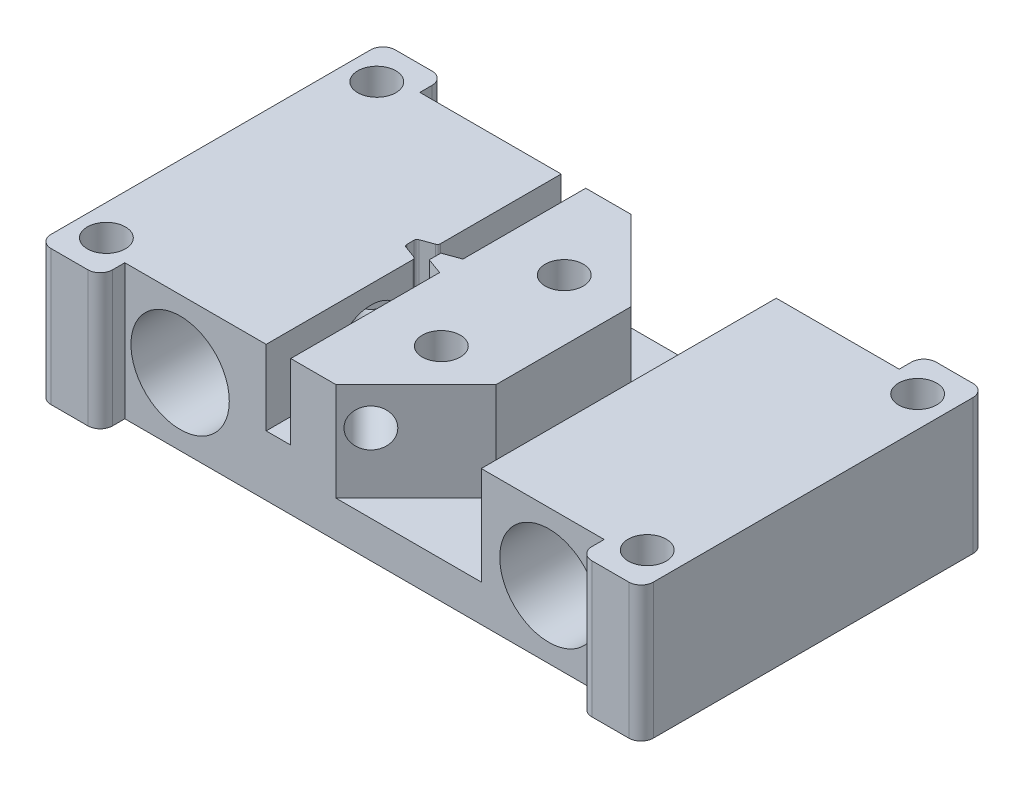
SolidWorks part; units mm, degrees
ref_plane "Piano frontale" through (0, 0, 0) normal (0, 0, 1) x (1, 0, 0)
ref_plane "Piano superiore" through (0, 0, 0) normal (0, 1, 0) x (1, 0, 0)
ref_plane "Piano destro" through (0, 0, 0) normal (1, 0, 0) x (0, 0, -1)
sketch "Schizzo8" plane through (0, 0, 0) normal (0, 1, 0) x (1, 0, 0)
  line L0 (-8, -1) -> (-6.9455, -1.3838)
  line L1 (-6.9455, -2.2061) -> (-7.32, -2.3424)
  line L2 (-6.86, -1.7949) -> (-8, -1.7949) construction
  line L3 (-8, -1) -> (-8, -2.5899)
  line L4 (-6.86, -1.506) -> (-6.86, -2.0839)
  line L5 (-7.32, -2.3424) -> (-7.32, -3.2795)
  line L6 (-8, -2.5899) -> (-8, -19.783)
  line L7 (-7.32, -4.3744) -> (-7.32, -5.3115)
  line L8 (-7.32, -6.4064) -> (-7.32, -7.3435)
  line L9 (-8, -3.032) -> (-8, -4.6219)
  line L10 (-6.9455, -4.2381) -> (-7.32, -4.3744)
  line L11 (-6.86, -3.538) -> (-6.86, -4.1159)
  line L12 (-7.32, -3.2795) -> (-6.9455, -3.4158)
  line L13 (-8, -5.064) -> (-8, -6.6539)
  line L14 (-6.9455, -6.2701) -> (-7.32, -6.4064)
  line L15 (-6.86, -5.57) -> (-6.86, -6.1479)
  line L16 (-7.32, -5.3115) -> (-6.9455, -5.4478)
  line L17 (-8, -7.096) -> (-8, -8.6859)
  line L18 (-6.9455, -8.3021) -> (-7.32, -8.4384)
  line L19 (-6.86, -7.602) -> (-6.86, -8.1799)
  line L20 (-7.32, -7.3435) -> (-6.9455, -7.4798)
  line L21 (-8, -9.128) -> (-8, -10.7179)
  line L22 (-6.9455, -10.3341) -> (-7.32, -10.4704)
  line L23 (-6.86, -9.634) -> (-6.86, -10.2119)
  line L24 (-7.32, -9.3755) -> (-6.9455, -9.5118)
  line L25 (-8, -11.16) -> (-8, -12.7499)
  line L26 (-6.9455, -12.3661) -> (-7.32, -12.5024)
  line L27 (-6.86, -11.666) -> (-6.86, -12.2439)
  line L28 (-7.32, -11.4075) -> (-6.9455, -11.5438)
  line L29 (-8, -13.192) -> (-8, -14.7819)
  line L30 (-6.9455, -14.3981) -> (-7.32, -14.5344)
  line L31 (-6.86, -13.698) -> (-6.86, -14.2759)
  line L32 (-7.32, -13.4395) -> (-6.9455, -13.5758)
  line L33 (-8, -15.224) -> (-8, -16.8139)
  line L34 (-6.9455, -16.4301) -> (-7.32, -16.5664)
  line L35 (-6.86, -15.73) -> (-6.86, -16.3079)
  line L36 (-7.32, -15.4715) -> (-6.9455, -15.6078)
  line L37 (-8, -17.256) -> (-8, -18.8459)
  line L38 (-6.9455, -18.4621) -> (-7.32, -18.5984)
  line L39 (-6.86, -17.762) -> (-6.86, -18.3399)
  line L40 (-7.32, -17.5035) -> (-6.9455, -17.6398)
  line L41 (-8, -19.288) -> (-8, -19.783)
  line L45 (-7.32, -10.4704) -> (-7.32, -11.4075)
  line L46 (-7.32, -12.5024) -> (-7.32, -13.4395)
  line L47 (-7.32, -8.4384) -> (-7.32, -9.3755)
  line L48 (-7.32, -14.5344) -> (-7.32, -15.4715)
  line L49 (-7.32, -16.5664) -> (-7.32, -17.5035)
  line L50 (-7.32, -18.5984) -> (-7.32, -19.5355)
  line L52 (-7.32, -19.5355) -> (-8, -19.783)
  line L54 (-6.86, -19.794) -> (-6.86, -20.3719)
  line L55 (8.3119, -25.225) -> (8.6864, -25.3613)
  line L56 (22.6248, -9.7313) -> (21.5704, -10.1151)
  arc A0 (-6.86, -2.0839) -> (-6.9455, -2.2061) centre (-6.99, -2.0839) cw
  arc A1 (-6.86, -1.506) -> (-6.9455, -1.3838) centre (-6.99, -1.506) ccw
  arc A2 (-6.86, -4.1159) -> (-6.9455, -4.2381) centre (-6.99, -4.1159) cw
  arc A3 (-6.86, -3.538) -> (-6.9455, -3.4158) centre (-6.99, -3.538) ccw
  arc A4 (-6.86, -6.1479) -> (-6.9455, -6.2701) centre (-6.99, -6.1479) cw
  arc A5 (-6.86, -5.57) -> (-6.9455, -5.4478) centre (-6.99, -5.57) ccw
  arc A6 (-6.86, -8.1799) -> (-6.9455, -8.3021) centre (-6.99, -8.1799) cw
  arc A7 (-6.86, -7.602) -> (-6.9455, -7.4798) centre (-6.99, -7.602) ccw
  arc A8 (-6.86, -10.2119) -> (-6.9455, -10.3341) centre (-6.99, -10.2119) cw
  arc A9 (-6.86, -9.634) -> (-6.9455, -9.5118) centre (-6.99, -9.634) ccw
  arc A10 (-6.86, -12.2439) -> (-6.9455, -12.3661) centre (-6.99, -12.2439) cw
  arc A11 (-6.86, -11.666) -> (-6.9455, -11.5438) centre (-6.99, -11.666) ccw
  arc A12 (-6.86, -14.2759) -> (-6.9455, -14.3981) centre (-6.99, -14.2759) cw
  arc A13 (-6.86, -13.698) -> (-6.9455, -13.5758) centre (-6.99, -13.698) ccw
  arc A14 (-6.86, -16.3079) -> (-6.9455, -16.4301) centre (-6.99, -16.3079) cw
  arc A15 (-6.86, -15.73) -> (-6.9455, -15.6078) centre (-6.99, -15.73) ccw
  arc A16 (-6.86, -18.3399) -> (-6.9455, -18.4621) centre (-6.99, -18.3399) cw
  arc A17 (-6.86, -17.762) -> (-6.9455, -17.6398) centre (-6.99, -17.762) ccw
  arc A20 (-6.86, -19.794) -> (-6.9455, -19.6718) centre (-6.99, -19.794) ccw
  arc A21 (-6.86, -20.3719) -> (-6.9455, -20.4941) centre (-6.99, -20.3719) cw
  point P15 (-6.86, -2.1749)
  point P18 (-6.86, -1.4149)
  dimension "D5" = 0.13
  dimension "D1" = 20
  dimension "D2" = 0.76
  dimension "D3" = 0.9371
  dimension "D6" = 10
sketch "Schizzo1" plane through (0, 0, 0) normal (0, 0, 1) x (1, 0, 0)
  line L0 (-15, 0) -> (15, 0) construction
  line L2 (-24.5, -5.5) -> (24.5, -5.5)
  line L3 (-24.5, -5.5) -> (-24.5, 5.5)
  line L4 (-24.5, 5.5) -> (24.5, 5.5)
  line L5 (24.5, -5.5) -> (24.5, 5.5)
  line L6 (-24.5, -5.5) -> (24.5, 5.5) construction
  line L7 (-24.5, 5.5) -> (24.5, -5.5) construction
  circle A0 centre (-15, 0) radius 4
  circle A1 centre (15, 0) radius 4
  point P4 (0, 0)
  point P10 (0, 0)
  dimension "D2" = 8
  dimension "D1" = 30
  dimension "D3" = 11
  dimension "D4" = 49
extrude "Estrusione-Estrusione1" add sketch "Schizzo1" along normal blind 24
sketch "Schizzo3" plane through (0, 5.5, 0) normal (0, 1, 0) x (1, 0, 0)
  line L0 (24.5, 0) -> (-24.5, 0) construction
  line L1 (-8, 0) -> (-6, 0)
  line L2 (-8, 0) -> (-8, -9.8149)
  line L3 (-8, -24) -> (-6, -24)
  line L4 (-6, 0) -> (-6, -9.9899)
  line L5 (24.5, -24) -> (-24.5, -24) construction
  line L6 (0, 0) -> (0, -24) construction
  line L7 (8, -24) -> (6, -24) construction
  line L8 (8, 0) -> (8, -24) construction
  line L9 (6, 0) -> (6, -24) construction
  line L10 (8, 0) -> (6, 0) construction
  line L11 (-7.32, -10.4704) -> (-6, -9.9899)
  line L12 (-7.32, -11.4075) -> (-6, -11.8879)
  line L13 (-8.1645, -10.0498) -> (-9.1555, -10.4105)
  line L14 (-9.32, -10.6454) -> (-9.32, -11.2324)
  line L15 (-9.1555, -11.4674) -> (-8.1645, -11.8281)
  line L16 (-6, -11.8879) -> (-6, -24)
  line L17 (-8, -12.063) -> (-8, -24)
  line L18 (-7.32, -10.4704) -> (-7.32, -11.4075) construction
  line L19 (-6.9455, -10.3341) -> (-7.32, -10.4704) construction
  line L20 (-7.32, -11.4075) -> (-6.9455, -11.5438) construction
  line L21 (-7.32, -10.9389) -> (-9.32, -10.9389) construction
  line L22 (-8, -9.9899) -> (-6, -9.9899) construction
  line L23 (-7.32, -10.4704) -> (-7.32, -11.4075)
  arc A0 (-8.1645, -11.8281) -> (-8, -12.063) centre (-8.25, -12.063) cw
  arc A1 (-8.1645, -10.0498) -> (-8, -9.8149) centre (-8.25, -9.8149) ccw
  arc A2 (-9.32, -11.2324) -> (-9.1555, -11.4674) centre (-9.07, -11.2324) ccw
  arc A3 (-9.1555, -10.4105) -> (-9.32, -10.6454) centre (-9.07, -10.6454) ccw
  point P35 (-8, -11.8879)
  point P41 (-9.32, -11.4075)
  point P44 (-9.32, -10.4704)
  dimension "D3" = 0.25
  dimension "D1" = 2
  dimension "D2" = 6
extrude "Taglio-Estrusione2" cut sketch "Schizzo3" against normal blind 6.1
sketch "Schizzo4" plane through (0, 5.5, 0) normal (0, 1, 0) x (1, 0, 0)
  line L0 (24.5, 0) -> (-6, 0) construction
  line L1 (4.5, 0) -> (9.5, 0)
  line L2 (4.1898, -6.5) -> (4.1898, -17.5)
  line L3 (4.5, -24) -> (9.5, -24)
  line L4 (9.5, 0) -> (9.5, -24)
  line L6 (24.5, -24) -> (-6, -24) construction
  line L7 (4.1898, -17.5) -> (-2.3102, -24)
  line L8 (-2.3102, -24) -> (4.5, -24)
  line L9 (4.1898, -6.5) -> (-2.3102, 0)
  line L10 (24.5, 0) -> (-6, 0) construction
  line L11 (-2.3102, 0) -> (4.5, 0)
  line L12 (-2.3102, 0) -> (-2.3102, -24) construction
  dimension "D1" = 5
  dimension "D2" = 4.5
  dimension "D3" = 45
  dimension "D4" = 45
  dimension "D5" = 11
extrude "Taglio-Estrusione3" cut sketch "Schizzo4" against normal blind 8
sketch "Schizzo5" plane through (0, 5.5, 0) normal (0, 1, 0) x (1, 0, 0)
  line L1 (-24.5, 0) -> (-19.5, 0)
  line L2 (-24.5, 0) -> (-24.5, 2)
  line L3 (-24.5, 2) -> (-19.5, 2)
  line L4 (-19.5, 0) -> (-19.5, 2)
  line L5 (24.5, 0) -> (19.5, 0)
  line L6 (24.5, 0) -> (24.5, 2)
  line L7 (24.5, 2) -> (19.5, 2)
  line L8 (19.5, 0) -> (19.5, 2)
  line L9 (24.5, -24) -> (19.5, -24)
  line L10 (24.5, -24) -> (24.5, -26)
  line L11 (24.5, -26) -> (19.5, -26)
  line L12 (19.5, -24) -> (19.5, -26)
  line L13 (-24.5, -24) -> (-19.5, -24)
  line L14 (-24.5, -24) -> (-24.5, -26)
  line L15 (-24.5, -26) -> (-19.5, -26)
  line L16 (-19.5, -24) -> (-19.5, -26)
  dimension "D1" = 5
  dimension "D2" = 2
extrude "Estrusione-Estrusione2" add sketch "Schizzo5" against normal blind 11
sketch "Schizzo2" plane through (0, -5.5, 0) normal (0, -1, 0) x (1, 0, 0)
  line L0 (0, 0) -> (0, 24) construction
  line L1 (-19.5, 24) -> (19.5, 24) construction
  line L3 (-22, 1) -> (22, 1) construction
  line L4 (-22, 1) -> (-22, 23) construction
  line L5 (-22, 23) -> (22, 23) construction
  line L6 (22, 1) -> (22, 23) construction
  line L7 (-22, 1) -> (22, 23) construction
  line L8 (-22, 23) -> (22, 1) construction
  circle A0 centre (-22, 23) radius 1.55
  circle A1 centre (22, 23) radius 1.55
  circle A2 centre (22, 1) radius 1.55
  circle A3 centre (-22, 1) radius 1.55
  point P5 (0, 12)
  dimension "D1" = 3.1
  dimension "D2" = 44
  dimension "D3" = 22
extrude "Taglio-Estrusione1" cut sketch "Schizzo2" against normal through all
fillet "Raccordo1" radius 1 8 edges at (-24.5, 0, 26) (-19.5, 0, 26) (19.5, 0, 26) (24.5, 0, 26) (19.5, 0, -2) (24.5, 0, -2) (-19.5, 0, -2) (-24.5, 0, -2)
sketch "Schizzo6" plane through (0, 5.5, 0) normal (0, 1, 0) x (1, 0, 0)
  line L0 (-0.75, 0) -> (-0.75, -8.55) construction
  line L1 (-2.3102, 0) -> (-6, 0) construction
  line L3 (-0.75, -15.45) -> (-0.75, -24) construction
  line L4 (-0.75, -7) -> (-6, -7) construction
  line L5 (-6, -9.9899) -> (-6, 0) construction
  circle A0 centre (-0.75, -7) radius 1.55
  circle A1 centre (-0.75, -17) radius 1.55
  dimension "D2" = 3.1
  dimension "D1" = 10
  dimension "D3" = 7
  dimension "D4" = 5.25
extrude "Taglio-Estrusione4" cut sketch "Schizzo6" against normal blind 6
sketch "Schizzo7" plane through (0, -5.5, 0) normal (0, -1, 0) x (1, 0, 0)
  line L0 (-24.5, 12) -> (24.5, 12) construction
  line L1 (-24.5, 25) -> (-24.5, -1) construction
  line L2 (24.5, 25) -> (24.5, -1) construction
  line L4 (-15, 7) -> (15, 7) construction
  line L5 (-15, 7) -> (-15, 17) construction
  line L6 (-15, 17) -> (15, 17) construction
  line L7 (15, 7) -> (15, 17) construction
  line L8 (-15, 7) -> (15, 17) construction
  line L9 (-15, 17) -> (15, 7) construction
  circle A0 centre (-15, 17) radius 1.55
  circle A1 centre (15, 17) radius 1.55
  circle A2 centre (15, 7) radius 1.55
  circle A3 centre (-15, 7) radius 1.55
  point P6 (0, 12)
  dimension "D1" = 3.1
  dimension "D2" = 30
  dimension "D3" = 10
extrude "Taglio-Estrusione5" cut sketch "Schizzo7" against normal blind 6
sketch "Schizzo12" plane through (10.8449, 0, 10.8449) normal (0.7071, 0, 0.7071) x (0.7071, 0, -0.7071)
  line L0 (-21.2132, 2.45) -> (-16.6041, 2.45) construction
  line L1 (-21.2132, -0.6) -> (-21.2132, 5.5) construction
  line L2 (-18.6041, -2.5) -> (-18.6041, 5.5) construction
  circle A0 centre (-16.6041, 2.45) radius 1.55
  dimension "D1" = 3.1
  dimension "D2" = 2
extrude "Taglio-Estrusione7" cut sketch "Schizzo12" against normal blind 14
sketch "Schizzo13" plane through (-1.1551, 0, 1.1551) normal (0.7071, 0, -0.7071) x (-0.7071, 0, -0.7071)
  line L0 (4.2426, 2.45) -> (-6.7175, 2.45) construction
  line L1 (4.2426, -0.6) -> (4.2426, 5.5) construction
  line L2 (-6.7175, -2.5) -> (-6.7175, 5.5) construction
  line L3 (1.6336, -2.5) -> (1.6336, 5.5) construction
  circle A0 centre (-0.8664, 2.45) radius 1.55
  dimension "D1" = 3.1
  dimension "D2" = 2.5
